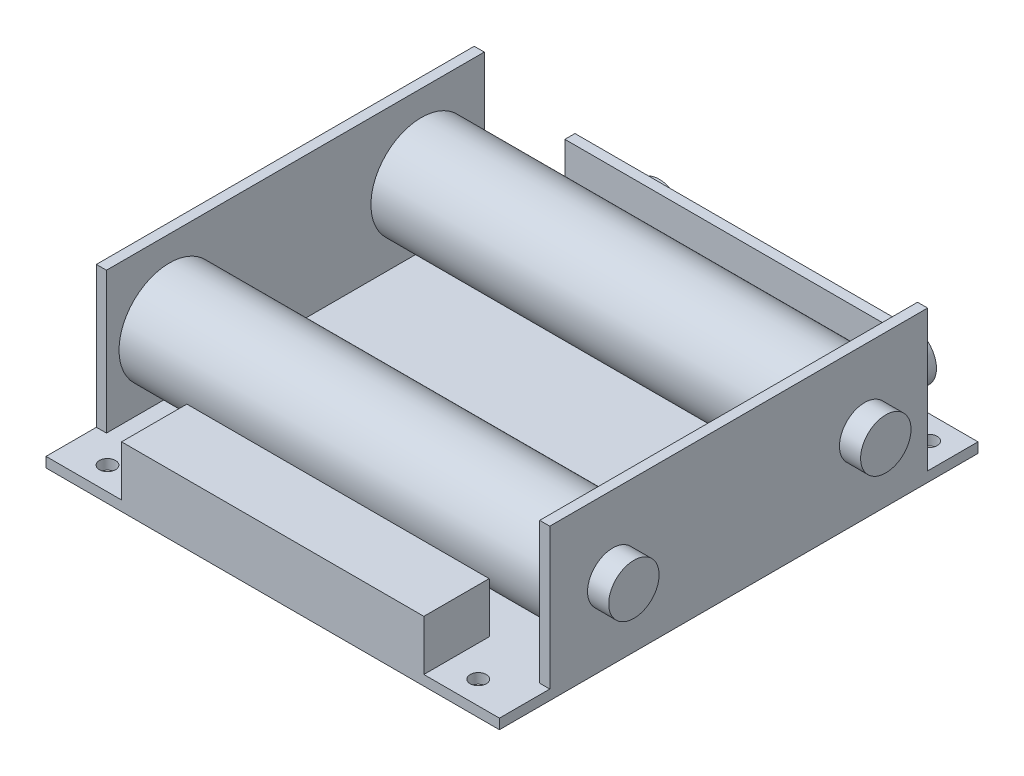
SolidWorks part; units mm, degrees
ref_plane "Front Plane" through (0, 0, 0) normal (0, 0, 1) x (1, 0, 0)
ref_plane "Top Plane" through (0, 0, 0) normal (0, 1, 0) x (1, 0, 0)
ref_plane "Right Plane" through (0, 0, 0) normal (1, 0, 0) x (0, 0, -1)
sketch "Sketch1" plane through (0, 0, 0) normal (0, 1, 0) x (1, 0, 0)
  line L1 (45, 47.5) -> (-45, 47.5)
  line L2 (45, 47.5) -> (45, -47.5)
  line L3 (45, -47.5) -> (-45, -47.5)
  line L4 (-45, 47.5) -> (-45, -47.5)
  line L5 (45, 47.5) -> (-45, -47.5) construction
  line L6 (45, -47.5) -> (-45, 47.5) construction
  point P0 (0, 0)
  dimension "D1" = 90
  dimension "D2" = 95
extrude "Boss-Extrude1" add sketch "Sketch1" along normal blind 2
hole_wizard "Ø3.2 (3.2) Diameter Hole1" positions "Sketch3" profile "Sketch2" hole size "Ø3.2" standard "ISO"
sketch "Sketch3" plane through (0, 0, 0) normal (0, -1, 0) x (-1, 0, 0)
  line L0 (45, 47.5) -> (45, -47.5) construction
  line L2 (45, -47.5) -> (-45, -47.5) construction
  line L3 (-45, -47.5) -> (-45, 47.5) construction
  line L4 (-45, 47.5) -> (45, 47.5) construction
  point P0 (37.4, -42.9)
  point P2 (-36.2, -42.9)
  point P4 (-40, 42.8)
  point P6 (40, 42.8)
  dimension "D1" = 7.6
  dimension "D2" = 4.6
  dimension "D3" = 8.8
  dimension "D4" = 4.6
  dimension "D5" = 4.7
  dimension "D6" = 5
  dimension "D7" = 4.7
  dimension "D8" = 5
sketch "Sketch2" plane through (-37.4, 0, 42.9) normal (1, 0, 0) x (0, 0, -1)
  line L0 (0, 0) -> (0, 2)
  line L1 (0, 2) -> (1.6, 2)
  line L2 (1.6, 2) -> (1.6, 0)
  line L5 (1.6, 0) -> (0, 0)
  line L11 (0, -6.35) -> (0, 107.95) construction
  dimension "Thru Hole Dia." = 3.2
  dimension "Thru Hole Depth" = 2
sketch "Sketch4" plane through (45, 0, 0) normal (1, 0, 0) x (0, 0, -1)
  line L0 (-47.5, 0) -> (47.5, 0) construction
  line L1 (-37.5, 0) -> (37.5, 0)
  line L2 (-37.5, 0) -> (-37.5, 30)
  line L3 (-37.5, 30) -> (37.5, 30)
  line L4 (37.5, 0) -> (37.5, 30)
  line L5 (-47.5, 2) -> (-47.5, 0) construction
  line L6 (47.5, 2) -> (47.5, 0) construction
  point P6 (-47.5, 1)
  dimension "D1" = 10
  dimension "D2" = 10
  dimension "D3" = 30
extrude "Boss-Extrude2" add sketch "Sketch4" against normal blind 2
mirror "Mirror1" about plane through (0, 0, 0) normal (1, 0, 0) of "Boss-Extrude2"
sketch "Sketch5" plane through (45, 0, 0) normal (1, 0, 0) x (0, 0, -1)
  line L0 (47.5, 2) -> (47.5, 0) construction
  line L2 (37.5, 30) -> (-37.5, 30) construction
  circle A0 centre (-25, 15) radius 5
  circle A1 centre (25, 15) radius 5
  point P4 (47.5, 1)
  dimension "D1" = 10
  dimension "D2" = 10
  dimension "D3" = 50
  dimension "D4" = 22.5
  dimension "D5" = 15
extrude "Boss-Extrude3" add sketch "Sketch5" along normal blind 4.2 and the other way blind 94.2
surface "Surface-Offset1" parameters "D1"=5
sketch "Sketch6" plane through (0, 2, 0) normal (0, 1, 0) x (1, 0, 0)
  line L0 (-45, -47.5) -> (45, -47.5) construction
  line L1 (-30, -34.5) -> (30, -34.5)
  line L2 (-30, -34.5) -> (-30, -47.5)
  line L3 (-30, -47.5) -> (30, -47.5)
  line L4 (30, -34.5) -> (30, -47.5)
  line L5 (-45, -37.5) -> (-45, -47.5) construction
  line L6 (45, -47.5) -> (45, -37.5) construction
  dimension "D1" = 15
  dimension "D2" = 15
  dimension "D3" = 13
extrude "Boss-Extrude4" add sketch "Sketch6" along normal blind 10
sketch "Sketch7" plane through (0, 0, -47.5) normal (0, 0, -1) x (-1, 0, 0)
  line L0 (-45, 0) -> (45, 0) construction
  line L1 (-35, 0) -> (35, 0)
  line L2 (-35, 0) -> (-35, 15)
  line L3 (-35, 15) -> (35, 15)
  line L4 (35, 0) -> (35, 15)
  line L5 (-45, 2) -> (-45, 0) construction
  line L6 (45, 2) -> (45, 0) construction
  point P6 (-45, 1)
  dimension "D1" = 10
  dimension "D2" = 10
  dimension "D3" = 15
extrude "Boss-Extrude5" add sketch "Sketch7" against normal blind 2
sketch "Sketch8" plane through (0, 0, -47.5) normal (0, 0, -1) x (-1, 0, 0)
  line L1 (-45, 0) -> (45, 0) construction
  line L2 (-35, 15) -> (-35, 2) construction
  line L3 (35, 2) -> (35, 15) construction
  circle A0 centre (-27.55, 6.3) radius 5
  circle A1 centre (22.45, 6.3) radius 5
  point P6 (-35, 8.5)
  dimension "D1" = 10
  dimension "D2" = 10
  dimension "D3" = 6.3
  dimension "D4" = 7.45
  dimension "D5" = 12.55
extrude "Boss-Extrude6" add sketch "Sketch8" along normal blind 4.2
